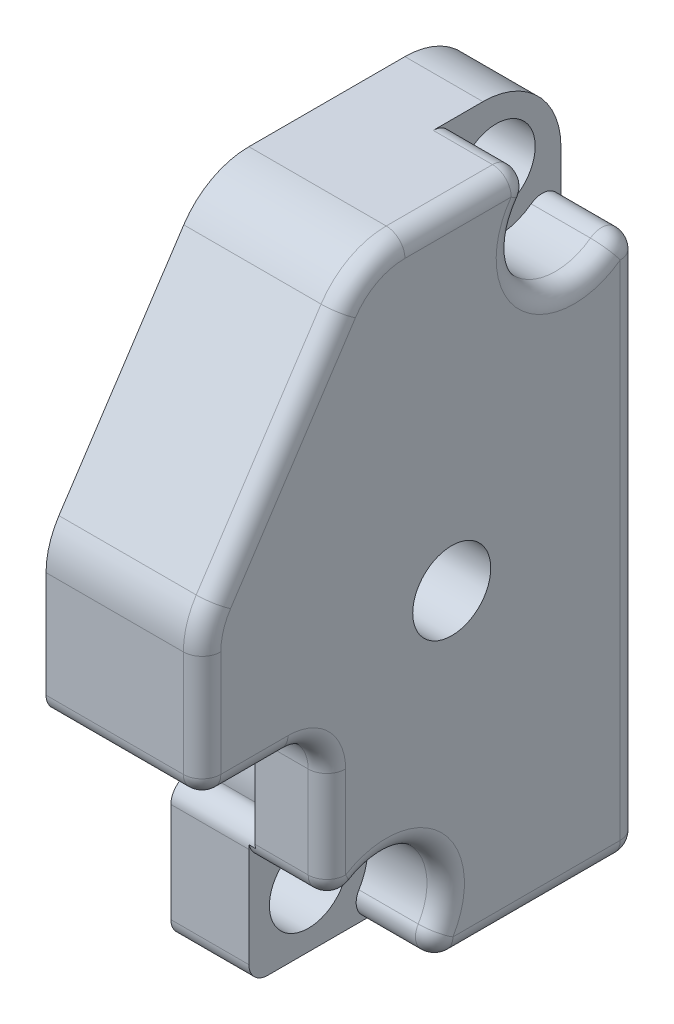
SolidWorks part; units mm, degrees
ref_plane "Front Plane" through (0, 0, 0) normal (0, 0, 1) x (1, 0, 0)
ref_plane "Top Plane" through (0, 0, 0) normal (0, 1, 0) x (1, 0, 0)
ref_plane "Right Plane" through (0, 0, 0) normal (1, 0, 0) x (0, 0, -1)
sketch "Sketch1" plane through (0, 0, 0) normal (1, 0, 0) x (0, 0, -1)
  line L0 (0, 0) -> (0, -10.4509) construction
  line L1 (-5.08, -12.9909) -> (7.62, -12.9909)
  line L3 (-1.905, 13.4251) -> (4.445, 13.4251)
  line L4 (7.62, -12.9909) -> (7.62, 10.2501)
  line L5 (-4.318, -13.2449) -> (6.858, -13.2449) construction
  line L6 (7.62, -14.0069) -> (7.62, 10.2501) construction
  line L7 (-10.16, 2.54) -> (-10.16, -2.54)
  line L8 (-1.905, 13.4251) -> (4.445, 13.4251) construction
  line L10 (-6.6675, -2.54) -> (-10.16, -2.54)
  line L12 (-5.08, 4.6125) -> (-5.08, 10.2501) construction
  line L13 (-4.5563, 11.9969) -> (-9.6363, 4.2869)
  line L15 (-5.08, -4.1275) -> (-5.08, -12.9909)
  circle A0 centre (0, 0) radius 1.5875
  arc A1 (4.445, 13.4251) -> (7.62, 10.2501) centre (4.445, 10.2501) cw
  arc A2 (-4.5563, 11.9969) -> (-1.905, 13.4251) centre (-1.905, 10.2501) cw
  arc A3 (7.62, 10.2501) -> (4.445, 13.4251) centre (4.445, 10.2501) ccw construction
  arc A4 (-10.16, 2.54) -> (-9.6363, 4.2869) centre (-6.985, 2.54) cw
  arc A6 (-1.905, 13.4251) -> (-5.08, 10.2501) centre (-1.905, 10.2501) ccw construction
  arc A7 (-5.08, -4.1275) -> (-6.6675, -2.54) centre (-6.6675, -4.1275) ccw
  point P23 (-5.08, 12.1551)
  point P33 (-5.08, 0)
  dimension "D3" = 3.175
  dimension "D2" = 5.08
  dimension "D4" = 2.54
  dimension "D5" = 1.5875
  dimension "D1" = 0.254
  dimension "D6" = 5.08
extrude "Boss-Extrude1" add sketch "Sketch1" along normal blind 6.35
sketch "Sketch2" plane through (0, 0, 0) normal (-1, 0, 0) x (0, 0, 1)
  line L0 (-7.62, 7.0803) -> (-4.4268, 7.0803)
  line L2 (-7.62, -12.9909) -> (-7.62, 10.2501) construction
  line L4 (7.0803, -4.662) -> (7.0803, -4.4268)
  line L14 (-7.62, 7.0803) -> (-7.62, -3.7148)
  arc A2 (7.0803, -4.4268) -> (-4.4268, 7.0803) centre (0, 0) ccw
  circle A5 centre (0, 0) radius 8.0963 construction
  arc A8 (-7.62, -3.7148) -> (7.0803, -4.662) centre (0, 0) ccw
  dimension "D4" = 0.127
  dimension "D1" = 0.254
  dimension "D2" = 1.27
  dimension "D3" = 1.27
extrude "Cut-Extrude1" cut sketch "Sketch2" against normal blind 3.429 and the other way through all
sketch "Sketch4" plane through (3.429, 0, 0) normal (-1, 0, 0) x (0, 0, 1)
  circle A0 centre (0, 0) radius 5.5562
  dimension "D1" = 11.1125
extrude "Cut-Extrude3" cut sketch "Sketch4" against normal blind 0.381
hole_wizard "1/8 (0.125) Diameter Hole1" positions "Sketch5" profile "Sketch6" hole size "1/8" standard "ANSI Inch"
sketch "Sketch5" plane through (6.35, 0, 0) normal (1, 0, 0) x (0, 0, -1)
  line L1 (-5.08, -12.9909) -> (7.62, -12.9909) construction
  line L2 (6.6901, 12.4951) -> (4.9838, 10.7889) construction
  line L5 (4.9838, 10.7889) -> (7.62, 10.2501) construction
  line L6 (4.9838, 10.7889) -> (4.445, 13.4251) construction
  line L7 (-5.08, -4.1275) -> (-5.08, -12.9909) construction
  circle A6 centre (-2.6586, -10.5695) radius 2.4214 construction
  arc A7 (-5.08, -6.7866) -> (7.62, -3.7148) centre (0, 0) ccw construction
  circle A8 centre (4.9838, 10.7889) radius 2.413 construction
  arc A12 (7.62, 10.2501) -> (4.445, 13.4251) centre (4.445, 10.2501) ccw construction
  point P0 (-2.6586, -10.5695)
  point P2 (4.9838, 10.7889)
  point P75 (2.4929, 10.7948)
  point P76 (0, 0)
  point P77 (0, 0)
  point P78 (7.62, 10.2501)
  point P80 (6.6901, 12.4951)
  point P84 (4.445, 13.4251)
  point P86 (0, 0)
  point P87 (0, 0)
  point P88 (0, 0)
  point P89 (0, 0)
  point P90 (-2.0512, -10.7642)
  dimension "D1" = 4.826
sketch "Sketch6" plane through (6.35, -10.5695, 2.6586) normal (0, 1, 0) x (0, 0, -1)
  line L0 (0, 0) -> (0, 6.35)
  line L1 (0, 6.35) -> (1.5875, 6.35)
  line L2 (1.5875, 6.35) -> (1.5875, 0)
  line L5 (1.5875, 0) -> (0, 0)
  line L11 (0, -6.35) -> (0, 107.95) construction
  dimension "Thru Hole Dia." = 3.175
  dimension "Thru Hole Depth" = 6.35
sketch "Sketch7" plane through (6.35, 0, 0) normal (1, 0, 0) x (0, 0, -1)
  line L1 (-2.6586, -10.5695) -> (-5.08, -12.9909) construction
  line L6 (3.5045, 12.6952) -> (4.445, 13.4251)
  line L7 (4.445, 13.4251) -> (-1.905, 13.4251) construction
  line L10 (6.8902, 9.3096) -> (7.62, 10.2501)
  line L15 (7.62, -12.9909) -> (7.62, 10.2501) construction
  line L18 (-4.3648, -8.8632) -> (-5.08, -9.5784)
  line L19 (-5.08, -4.1275) -> (-5.08, -12.9909) construction
  line L20 (-5.08, -9.5784) -> (-5.08, -12.9909)
  line L21 (-5.08, -12.9909) -> (-1.6675, -12.9909)
  line L22 (-5.08, -12.9909) -> (7.62, -12.9909) construction
  line L23 (-1.6675, -12.9909) -> (-0.9523, -12.2757)
  arc A0 (3.5045, 12.6952) -> (6.8902, 9.3096) centre (4.9838, 10.7889) ccw
  arc A1 (-0.9523, -12.2757) -> (-4.3648, -8.8632) centre (-2.6586, -10.5695) ccw
  arc A3 (4.445, 13.4251) -> (7.62, 10.2501) centre (4.445, 10.2501) cw
  arc A5 (7.62, 10.2501) -> (4.445, 13.4251) centre (4.445, 10.2501) ccw construction
  circle A6 centre (4.9838, 10.7889) radius 1.5875 construction
  circle A8 centre (-2.6586, -10.5695) radius 1.5875 construction
  point P17 (0, 0)
  dimension "D1" = 4.826
extrude "Cut-Extrude4" cut sketch "Sketch7" against normal blind 3.175
fillet "Fillet4" radius 0.762 6 edges at (4.7625, 13.4251, -4.445) (4.7625, 10.2501, -7.62) (4.7625, -12.9909, 1.6675) (4.7625, -9.5784, 5.08) (6.35, 9.0827, -3.2776) (6.35, -8.8632, 0.9523)
fillet "Fillet5" radius 0.762 22 edges at (6.2525, -12.5266, 0.6532) (6.2525, 8.9494, -7.0976) (6.2525, 12.9027, -3.1443) (6.35, 13.4251, -0.258) (6.35, 13.0453, 3.4107) (6.35, 8.1419, 7.0963) (6.35, 3.4518, 10.0262) (6.35, -2.54, 8.4138) (6.35, -3.005, 5.545) (6.2525, -8.5641, 4.6156) (1.7145, 7.0803, -7.62) (1.7145, -2.54, 7.9546) (1.7145, -6.7866, 5.08) (6.35, -12.9909, -3.8341) (6.35, -2.3824, -7.62) (6.35, 0, 10.16) (6.35, -5.9951, 5.08) (3.175, -2.54, 10.16) (1.5875, -12.9909, 5.08) (3.175, -12.9909, -7.62)
